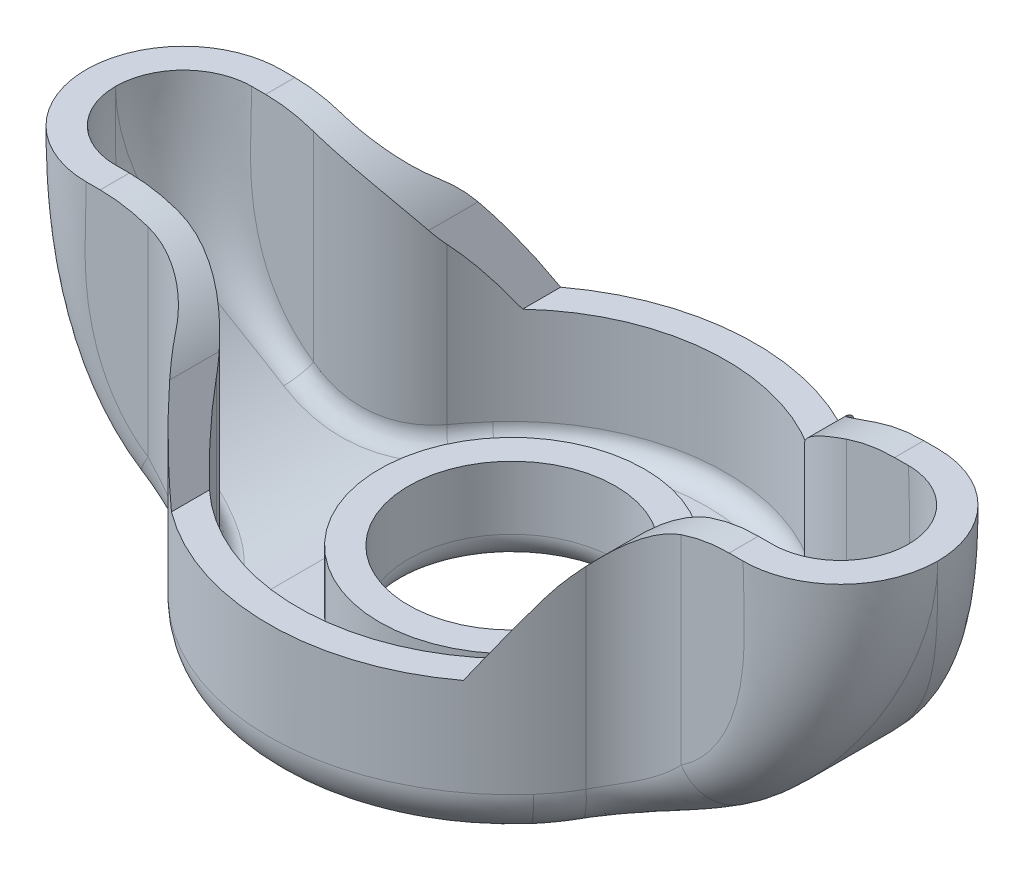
SolidWorks part; units mm, degrees
ref_plane "Front Plane" through (0, 0, 0) normal (0, 0, 1) x (1, 0, 0)
ref_plane "Top Plane" through (0, 0, 0) normal (0, 1, 0) x (1, 0, 0)
ref_plane "Right Plane" through (0, 0, 0) normal (1, 0, 0) x (0, 0, -1)
other "Configuration Table"
sketch "BaseNutSke" plane through (0, 0, 0) normal (0, 1, 0) x (1, 0, 0)
  line L0 (0, 73.6257) -> (0, -72.8166) construction
  line L1 (17.5, -4) -> (9.1652, -4)
  line L2 (-17.5, -4) -> (-9.1652, -4)
  line L3 (0, 0) -> (40.2198, 0) construction
  line L4 (-17.5, 4) -> (-9.1652, 4)
  line L5 (17.5, 4) -> (9.1652, 4)
  line L6 (-17.5, 4) -> (-17.5, -4)
  line L7 (17.5, -4) -> (17.5, 4)
  arc A0 (-9.1652, -4) -> (9.1652, -4) centre (0, 0) ccw
  arc A2 (9.1652, 4) -> (-9.1652, 4) centre (0, 0) ccw
extrude "BaseNut" add sketch "BaseNutSke" against normal blind 12
sketch "CutNutSke" plane through (0, 0, 0) normal (0, 0, 1) x (1, 0, 0)
  line L0 (0, 0) -> (0, -18.7628) construction
  line L1 (-17.5, 0) -> (-12.9282, 0)
  line L2 (-7.7321, -3) -> (-6, -6)
  line L3 (-6, -6) -> (6, -6)
  line L4 (6, -12) -> (-6, -12)
  line L5 (-9.1652, -12) -> (9.1652, -12) construction
  line L6 (-17.5, 0) -> (-17.5, 13.115) construction
  line L8 (-17.5, -12) -> (-17.5, 0) construction
  line L10 (17.5, 0) -> (12.9282, 0)
  line L11 (7.7321, -3) -> (6, -6)
  line L12 (-17.5, -12) -> (-17.5, 0) construction
  line L13 (-25, 3) -> (25, 3)
  line L14 (-25, 3) -> (-25, -17)
  line L15 (-25, -17) -> (25, -17)
  line L16 (25, 3) -> (25, -17)
  line L17 (-17.5, 0) -> (-9.1652, 0) construction
  line L18 (-17.5, 0) -> (-9.1652, 0) construction
  arc A1 (-12.9282, 0) -> (-7.7321, -3) centre (-12.9282, -6) cw
  arc A3 (12.9282, 0) -> (7.7321, -3) centre (12.9282, -6) ccw
  ellipse E0 centre (6, 0) end of major axis (6, -12) minor radius 11.5 (6, -12) -> (17.5, 0) ccw
  ellipse E1 centre (-6, 0) end of major axis (-6, -12) minor radius 11.5 (-6, -12) -> (-17.5, 0) cw
  point P18 (0, -12)
  point P24 (0, -6)
extrude "CutNut" cut sketch "CutNutSke" against normal mid plane 20
fillet "Fillet1" radius 3 4 edges at (-9.1652, -6.4316, 4) (9.1652, -6.4316, 4) (-9.1652, -6.4316, -4) (9.1652, -6.4316, -4)
fillet "WingFillet" radius 2 4 edges at (15.7269, -6.4016, 4) (15.7269, -6.4016, -4) (-15.7269, -6.4016, -4) (-15.7269, -6.4016, 4)
sketch "HoleSke" plane through (0, -12, 0) normal (0, -1, 0) x (1, 0, 0)
  circle A0 centre (0, 0) radius 4.25
  dimension "Tap_drill" = 8.5
extrude "TappedHole" cut sketch "HoleSke" against normal blind 3.8
fillet "HoleFillet" radius 1.2 1 edges at (0, -12, -4.25)
shell "NutShell" thickness 1.2
sketch "HTSke" plane through (0, -8.2, 0) normal (0, 1, 0) x (1, 0, 0)
  circle A0 centre (0, 0) radius 4.25 construction
  circle A1 centre (0, 0) radius 5.45
  circle A2 centre (0, 0) radius 5.45
  circle A3 centre (0, 0) radius 4.25
  dimension "D1" = 0
extrude "HightType" [suppressed] add sketch "HTSke" along normal blind 3.2
sketch "ThdSchSke" plane through (0, 0, 0) normal (0, 0, 1) x (1, 0, 0)
  line L0 (-4.25, -10.8) -> (4.25, -10.8) construction
  line L1 (-4.25, -10.8) -> (4.25, -10.8) construction
  line L2 (-4.25, -10.8) -> (-5, -10.367)
  line L3 (-5, -10.367) -> (-4.25, -9.934)
  line L4 (-4.25, -9.934) -> (-3.384, -9.934)
  line L5 (-3.384, -9.934) -> (-3.384, -10.8)
  line L6 (-3.384, -10.8) -> (-4.25, -10.8)
  line L7 (0, 0) -> (0, -20.3332) construction
revolve "ThreadSchematic" [suppressed] cut sketch "ThdSchSke" angle 360 about L7
pattern_linear "ThdSchPat" [suppressed] count 6 along (0, -1, 0)
equation "\"D3@CutNutSke\" = \"Base_width@CutNutSke\"/2"
equation "\"D1@CutNut\" = \"Nut_width@BaseNutSke\""
equation "\"D1@Fillet1\" = \"Nut_width@BaseNutSke\"*0.15"
equation "\"D3@WingFillet\" = \"Wing_width@BaseNutSke\"/2"
equation "\"D0@WingFillet\" = \"Wing_width@BaseNutSke\"/2"
equation "\"D7@WingFillet\" = \"Wing_width@BaseNutSke\"/2"
equation "\"D4@WingFillet\" = \"Wing_width@BaseNutSke\"/2"
equation "\"D5@WingFillet\" = \"Wing_width@BaseNutSke\"/4"
equation "\"D2@WingFillet\" = \"Wing_width@BaseNutSke\"/4"
equation "\"D6@WingFillet\" = \"Wing_width@BaseNutSke\"/4"
equation "\"D1@WingFillet\" = \"Wing_width@BaseNutSke\"/4"
equation "\"D1@NutShell\" = \"Thickness@HoleFillet\""
equation "\"ThreadN@ThdSchSke\" = \"Thread_major@ThreadCosmetic\""
equation "\"D1@ThdSchPat\" =  int( \"Inner_Hole_Low@TappedHole\"/\"Advance@ThdSchPat\" ) *2+2"
